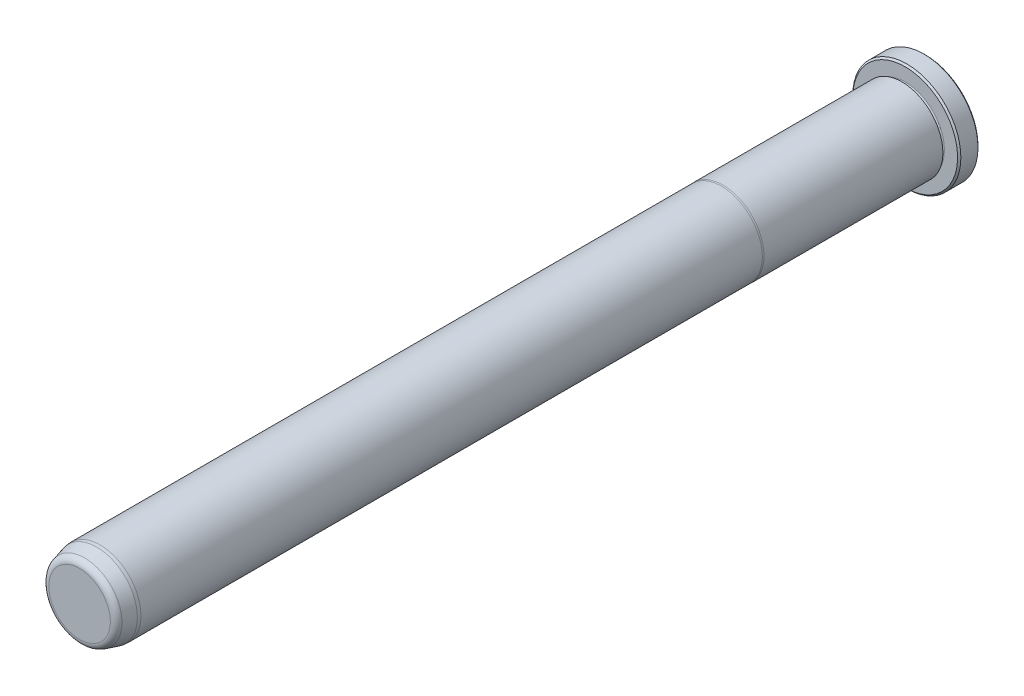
SolidWorks part; units mm, degrees
ref_plane "Front Plane" through (0, 0, 0) normal (0, 0, 1) x (1, 0, 0)
ref_plane "Top Plane" through (0, 0, 0) normal (0, 1, 0) x (1, 0, 0)
ref_plane "Right Plane" through (0, 0, 0) normal (1, 0, 0) x (0, 0, -1)
sketch "Sketch1" plane through (0, 0, 0) normal (1, 0, 0) x (0, 0, -1)
  line L0 (0, 0) -> (0, 12.573)
  line L1 (0, 12.573) -> (-4.7498, 12.573)
  line L2 (-4.7498, 12.573) -> (-4.7498, 9.1313)
  line L3 (-4.7498, 8.7503) -> (-5.5118, 8.7503) construction
  line L4 (-5.5118, 9.1313) -> (-5.5118, 9.5377)
  line L5 (-5.5118, 9.5377) -> (-47.1348, 9.5377)
  line L6 (-47.1348, 9.5377) -> (-47.498, 9.5123)
  line L7 (-47.498, 9.5123) -> (-192.0875, 9.5123)
  line L9 (-196.85, 8.3737) -> (-196.85, 0)
  line L10 (-196.85, 0) -> (0, 0)
  line L11 (0, 0) -> (13.6287, 0) construction
  line L12 (-192.0875, 9.5123) -> (-192.8495, 9.4456)
  line L13 (-192.8495, 9.4456) -> (-196.85, 8.3737)
  arc A0 (-5.5118, 9.1313) -> (-4.7498, 9.1313) centre (-5.1308, 9.1313) ccw
  dimension "D14" = 0.762
  dimension "D1" = 4.7498
  dimension "D2" = 0.762
  dimension "D3" = 25.146
  dimension "D4" = 19.0754
  dimension "D5" = 47.498
  dimension "D6" = 196.85
  dimension "D7" = 0.7874
  dimension "D8" = 4
  dimension "D9" = 19.0246
  dimension "D10" = 5
  dimension "D11" = 15
  dimension "D12" = 0.762
  dimension "D13" = 4.7625
revolve "Revolve1" add sketch "Sketch1" angle 360 about L11
fillet "Fillet6" radius 1.5875 1 edges at (8.3737, 0, 196.85)
chamfer "Chamfer1" distance 0.381 angle 45 2 edges at (12.573, 0, 0) (12.573, 0, 4.7498)
